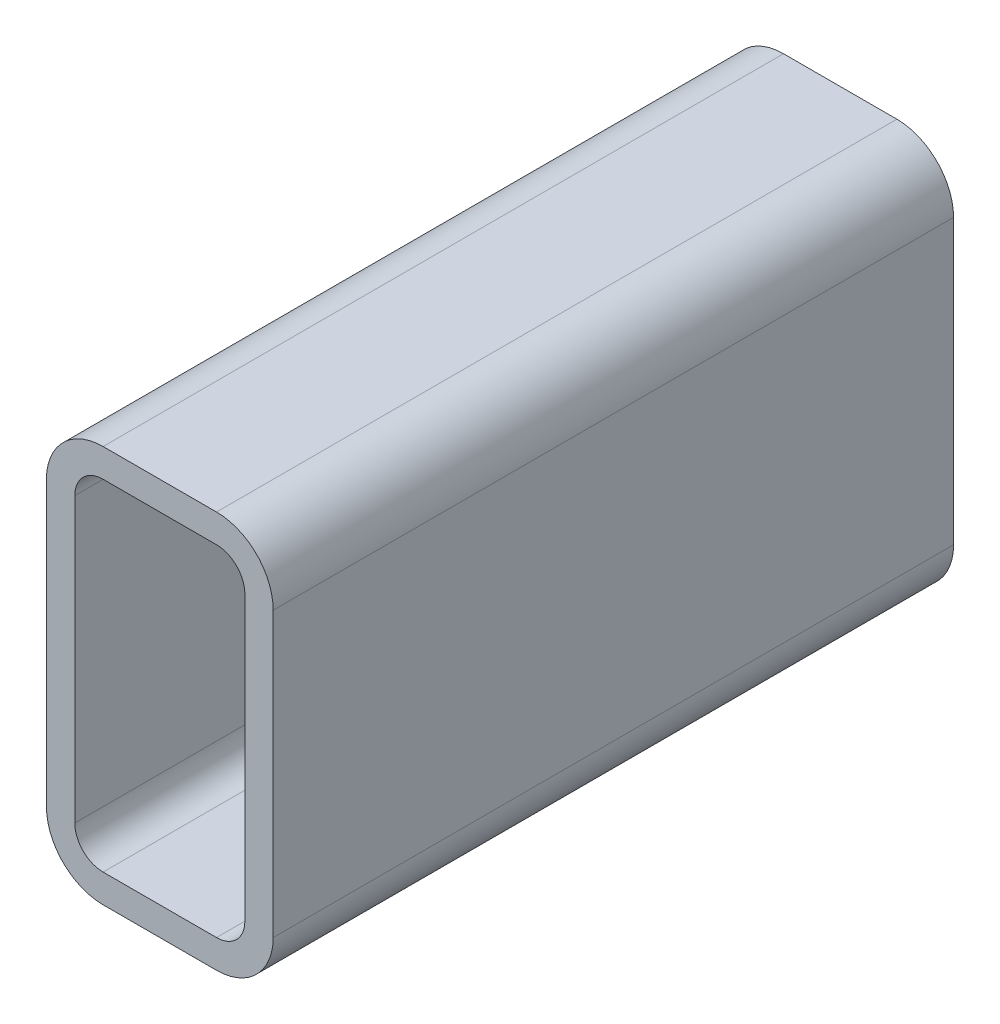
SolidWorks part; units mm, degrees
ref_plane "Front Plane" through (0, 0, 0) normal (0, 0, 1) x (1, 0, 0)
ref_plane "Top Plane" through (0, 0, 0) normal (0, 1, 0) x (1, 0, 0)
ref_plane "Right Plane" through (0, 0, 0) normal (1, 0, 0) x (0, 0, -1)
sketch "Sketch1" plane through (0, 0, 0) normal (0, 0, 1) x (1, 0, 0)
sketch_block_instance "HSS7x4x0.500-1"
sketch_block "HSS7x4x0.500"
extrude "Boss-Extrude1" add sketch "Sketch1" along normal blind 304.8
